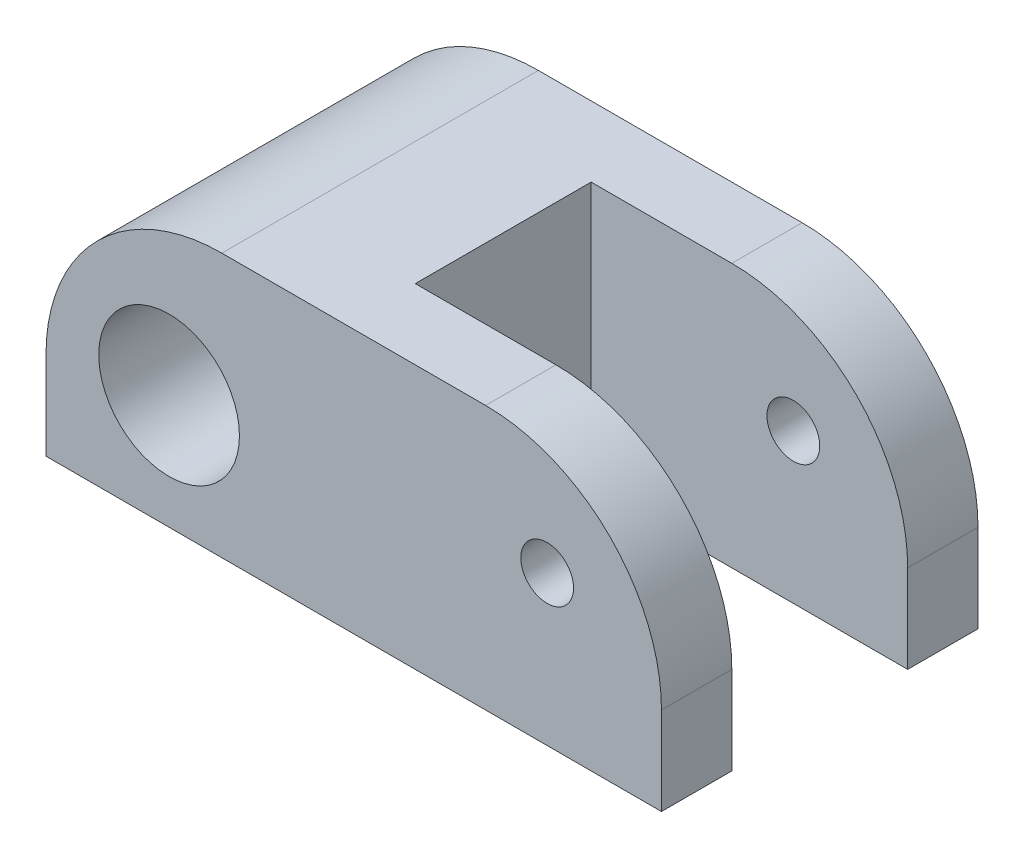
SolidWorks part; units mm, degrees
ref_plane "Alzado" through (0, 0, 0) normal (0, 0, 1) x (1, 0, 0)
ref_plane "Planta" through (0, 0, 0) normal (0, 1, 0) x (1, 0, 0)
ref_plane "Vista lateral" through (0, 0, 0) normal (1, 0, 0) x (0, 0, -1)
sketch "Croquis1" plane through (0, 0, 0) normal (0, 0, 1) x (1, 0, 0)
  line L1 (0, 0) -> (35, 0)
  line L2 (0, 0) -> (0, 15)
  line L3 (0, 15) -> (35, 15)
  line L4 (35, 0) -> (35, 15)
  circle A0 centre (7, 6.5) radius 4
  circle A1 centre (28.5, 8.5) radius 1.5
  dimension "D3" = 8
  dimension "D4" = 3
  dimension "D5" = 7
  dimension "D6" = 6.5
  dimension "D7" = 6.5
  dimension "D8" = 6.5
  dimension "D1" = 15
  dimension "D2" = 35
extrude "Saliente-Extruir1" add sketch "Croquis1" along normal mid plane 18
fillet "Redondeo1" radius 10 1 edges at (0, 15, 0)
fillet "Redondeo2" radius 10 1 edges at (35, 15, 0)
sketch "Croquis2" plane through (0, 15, 0) normal (0, 1, 0) x (1, 0, 0)
  line L0 (35, 9) -> (35, -9) construction
  line L5 (17, 5) -> (35, 5)
  line L6 (17, 5) -> (17, -5)
  line L7 (17, -5) -> (35, -5)
  line L8 (35, 5) -> (35, -5)
  line L9 (0, 0) -> (17, 0) construction
  dimension "D1" = 10
  dimension "D2" = 18
extrude "Cortar-Extruir1" cut sketch "Croquis2" against normal blind 18
